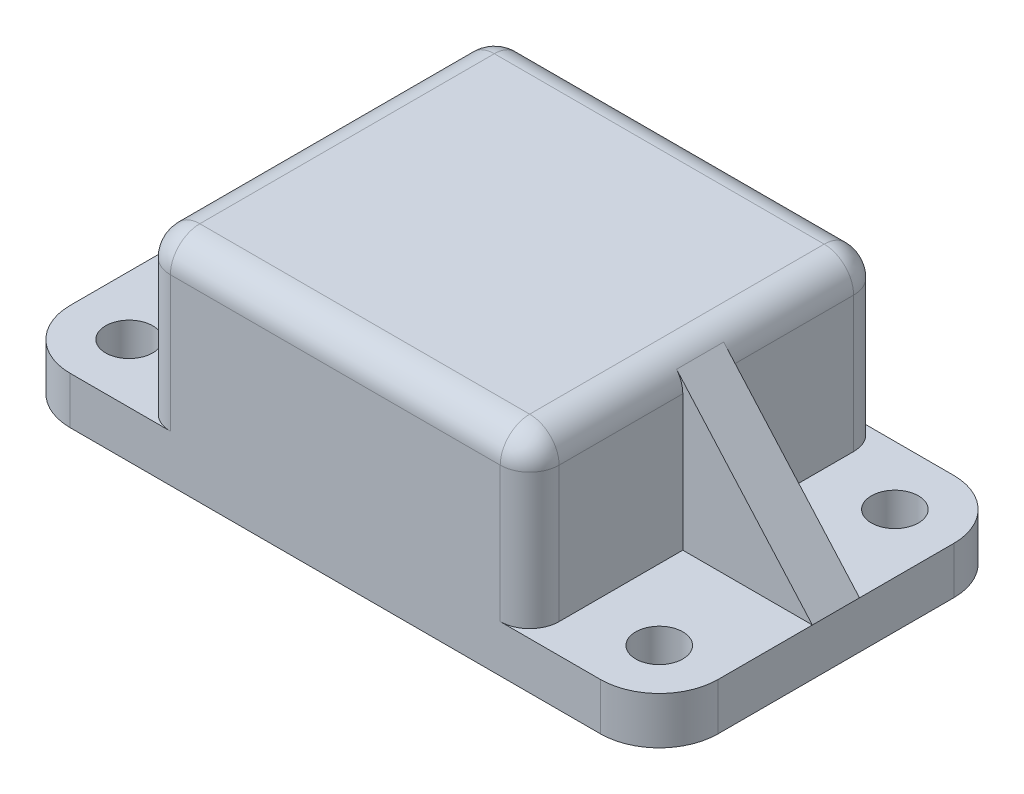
SolidWorks part; units mm, degrees
ref_plane "Front" through (0, 0, 0) normal (0, 0, 1) x (1, 0, 0)
ref_plane "Top" through (0, 0, 0) normal (0, 1, 0) x (1, 0, 0)
ref_plane "Right" through (0, 0, 0) normal (1, 0, 0) x (0, 0, -1)
sketch "Sketch2" plane through (0, 0, 0) normal (0, 0, 1) x (1, 0, 0)
  line L0 (-55, 0) -> (55, 0)
  line L1 (55, 0) -> (55, 8)
  line L2 (55, 8) -> (33, 8)
  line L3 (33, 8) -> (33, 36)
  line L4 (33, 36) -> (-33, 36)
  line L5 (-33, 36) -> (-33, 8)
  line L6 (-33, 8) -> (-55, 8)
  line L7 (-55, 8) -> (-55, 0)
  dimension "D1" = 110
  dimension "D2" = 55
  dimension "D3" = 8
  dimension "D4" = 22
  dimension "D5" = 66
extrude "Boss-Extrude1" add sketch "Sketch2" along normal mid plane 60
fillet "Fillet1" radius 10 4 edges at (-55, 4, -30) (-55, 4, 30) (55, 4, -30) (55, 4, 30)
fillet "Fillet2" radius 5 8 edges at (33, 36, 0) (-33, 36, 0) (-33, 22, 30) (0, 36, 30) (-33, 22, -30) (0, 36, -30) (33, 22, -30) (33, 22, 30)
other "Hole1"
sketch "Sketch3" plane through (0, 8, 0) normal (0, 1, 0) x (1, 0, 0)
  circle A0 centre (-45, -20) radius 4
  dimension "D1" = 8
  dimension "D2" = 10
  dimension "D3" = 10
pattern_linear "LPattern1" count 2 spacing 90 along (1, 0, 0) count 2 spacing 40 along (0, 0, -1) of "Hole1"
sketch "Sketch5" plane through (0, 0, 0) normal (0, 0, 1) x (1, 0, 0)
  line L0 (-55, 8) -> (-31.5355, 34.5355)
  arc A1 (-28, 36) -> (-33, 31) centre (-28, 31) ccw construction
rib "Rib1" sketch "Sketch5" sketch "Sketch5" thickness 8 extrusion direction parallel to sketch draft on no parameters "D1"=8
mirror "Mirror1" about plane through (0, 0, 0) normal (1, 0, 0) of "Rib1"
sketch "Sketch9" plane through (0, 0, 0) normal (0, -1, 0) x (1, 0, 0)
  line L1 (-26, -24) -> (26, -24)
  line L2 (-26, -24) -> (-26, 24)
  line L3 (-26, 24) -> (26, 24)
  line L4 (26, -24) -> (26, 24)
  line L5 (-26, -24) -> (26, 24) construction
  line L6 (-26, 24) -> (26, -24) construction
  point P0 (0, 0)
  dimension "D1" = 48
  dimension "D2" = 52
extrude "Cut-Extrude1" cut sketch "Sketch9" against normal blind 30 contours L3 L4 L1 L2
